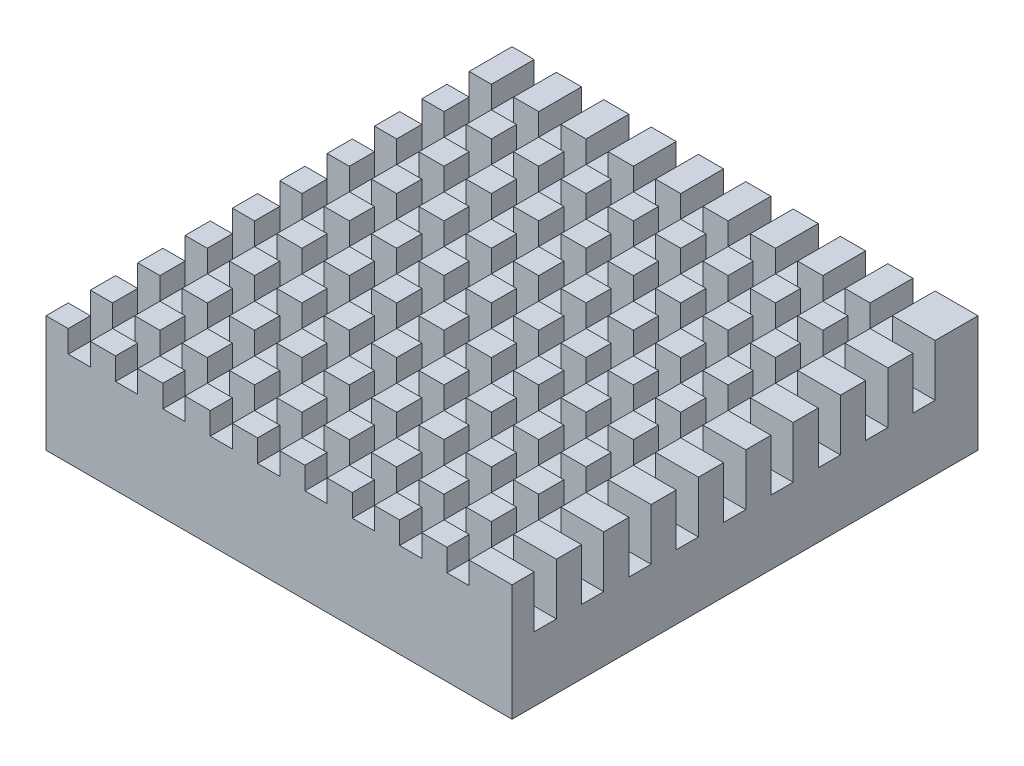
SolidWorks part; units mm, degrees
ref_plane "Front Plane" through (0, 0, 0) normal (0, 0, 1) x (1, 0, 0)
ref_plane "Top Plane" through (0, 0, 0) normal (0, 1, 0) x (1, 0, 0)
ref_plane "Right Plane" through (0, 0, 0) normal (1, 0, 0) x (0, 0, -1)
sketch "Sketch1" plane through (0, 0, 0) normal (0, 1, 0) x (1, 0, 0)
  line L1 (-20, -20) -> (20, -20)
  line L2 (-20, -20) -> (-20, 20)
  line L3 (-20, 20) -> (20, 20)
  line L4 (20, -20) -> (20, 20)
  line L5 (-20, -20) -> (20, 20) construction
  line L6 (-20, 20) -> (20, -20) construction
  point P0 (0, 0)
  dimension "D1" = 40
  dimension "D2" = 40
extrude "Boss-Extrude1" add sketch "Sketch1" along normal blind 10
sketch "Sketch2" plane through (0, 10, 0) normal (0, 1, 0) x (1, 0, 0)
  line L0 (-20, 20) -> (-20, -20) construction
  line L1 (-20, -18.095) -> (20, -18.095)
  line L2 (-20, -18.095) -> (-20, -16.19)
  line L3 (-20, -16.19) -> (20, -16.19)
  line L4 (20, -18.095) -> (20, -16.19)
  line L5 (20, -20) -> (20, 20) construction
  line L7 (-20, -20) -> (20, -20) construction
  dimension "D1" = 1.905
  dimension "D2" = 1.905
extrude "Cut-Extrude1" cut sketch "Sketch2" against normal blind 4.445
pattern_linear "LPattern1" count 9 spacing 4.064 along (0, 0, -1) of "Cut-Extrude1"
sketch "Sketch3" plane through (0, 10, 0) normal (0, 1, 0) x (1, 0, 0)
  line L0 (20, 20) -> (-20, 20) construction
  line L1 (-18.095, 20) -> (-16.19, 20)
  line L2 (-18.095, 20) -> (-18.095, -20)
  line L3 (-18.095, -20) -> (-16.19, -20)
  line L4 (-16.19, 20) -> (-16.19, -20)
  line L5 (-20, -20) -> (20, -20) construction
  line L6 (-20, 20) -> (-20, 16.322) construction
  dimension "D1" = 1.905
  dimension "D2" = 1.905
extrude "Cut-Extrude2" cut sketch "Sketch3" against normal blind 1.905
pattern_linear "LPattern2" count 9 spacing 4.064 along (1, 0, 0) of "Cut-Extrude2"
